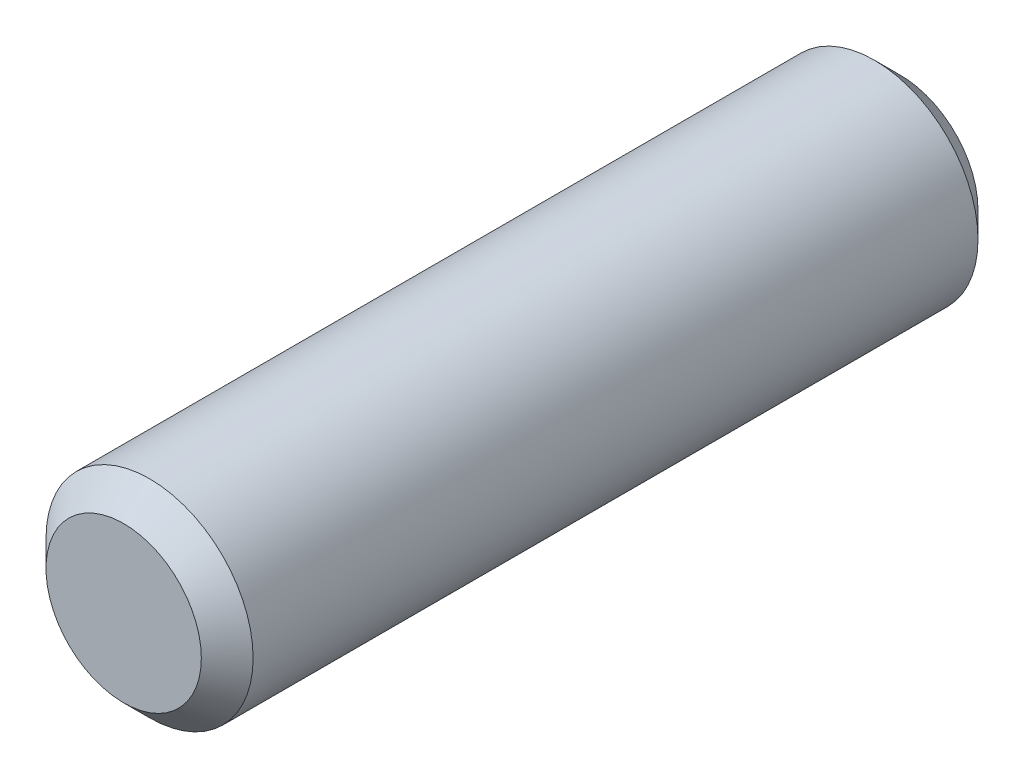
SolidWorks part; units mm, degrees
ref_plane "Plan1" through (0, 0, 0) normal (0, 0, 1) x (1, 0, 0)
ref_plane "Plan2" through (0, 0, 0) normal (0, 1, 0) x (1, 0, 0)
ref_plane "Plan3" through (0, 0, 0) normal (1, 0, 0) x (0, 0, -1)
sketch "Esquisse1" plane through (0, 0, 0) normal (0, 0, 1) x (1, 0, 0)
  circle A0 centre (0, 0) radius 4
  dimension "D1" = 8
extrude "Base-Extrusion" add sketch "Esquisse1" along normal blind 30
chamfer "Chanfrein1" distance 1 angle 45
chamfer "Chanfrein2" distance 1 angle 45
